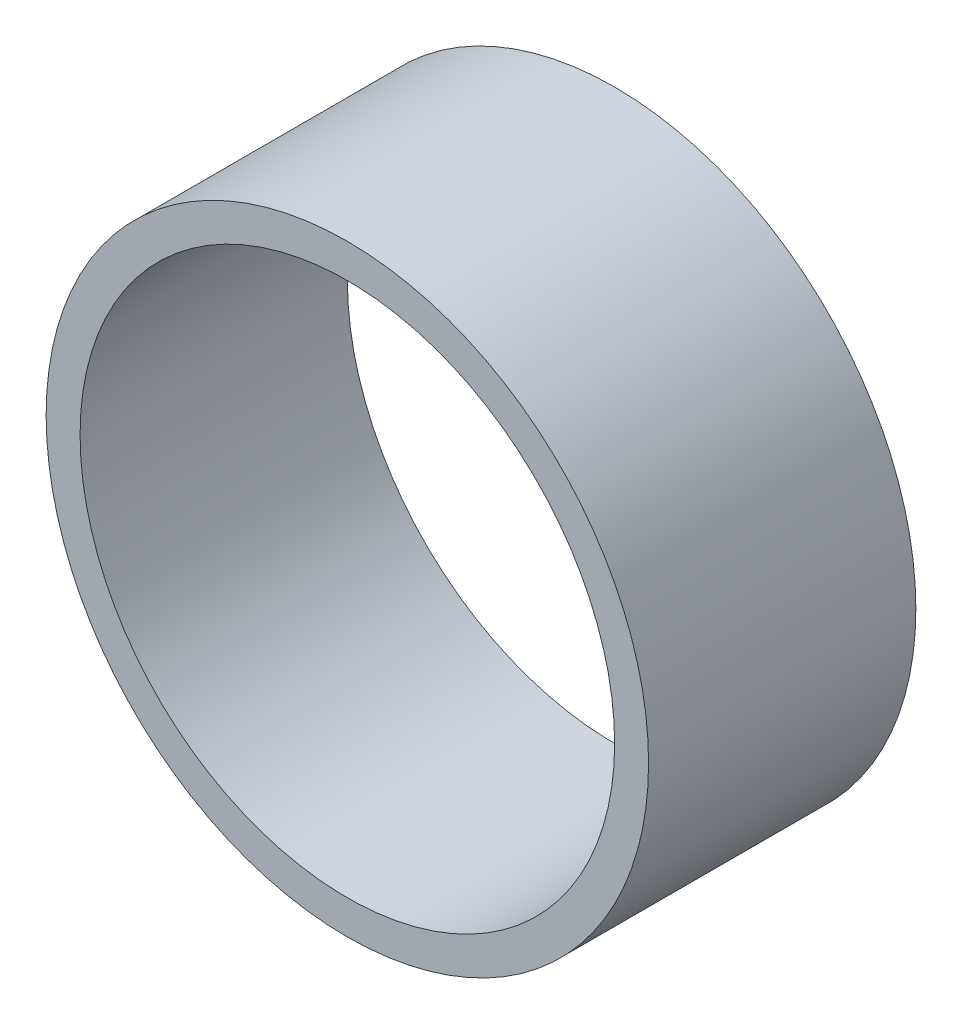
SolidWorks part; units mm, degrees
ref_plane "Front Plane" through (0, 0, 0) normal (0, 0, 1) x (1, 0, 0)
ref_plane "Top Plane" through (0, 0, 0) normal (0, 1, 0) x (1, 0, 0)
ref_plane "Right Plane" through (0, 0, 0) normal (1, 0, 0) x (0, 0, -1)
sketch "Sketch1" plane through (0, 0, 0) normal (0, 0, 1) x (1, 0, 0)
  circle A0 centre (0, 0) radius 14.3129
  circle A1 centre (0, 0) radius 12.7
  dimension "D1" = 28.6258
  dimension "ID" = 25.4
extrude "Extrude1" add sketch "Sketch1" along normal mid plane 12.7
sketch "Sketch2" plane through (0, 0, 0) normal (1, 0, 0) x (0, 0, -1)
  line L0 (-6.35, -12.7) -> (6.35, -12.7) construction
  line L3 (6.35, 12.7) -> (-6.35, 12.7) construction
  line L5 (-6.35, -12.7) -> (6.35, -12.7)
  line L6 (6.35, 12.7) -> (-6.35, 12.7)
sketch "Sketch4" plane through (0, 0, 6.35) normal (0, 0, 1) x (1, 0, 0)
  line L0 (0, 0) -> (-8.9803, 8.9803)
  line L1 (0, -17.4625) -> (0, 17.4625) construction
  circle A0 centre (0, 0) radius 12.7 construction
  dimension "D1" = 45
